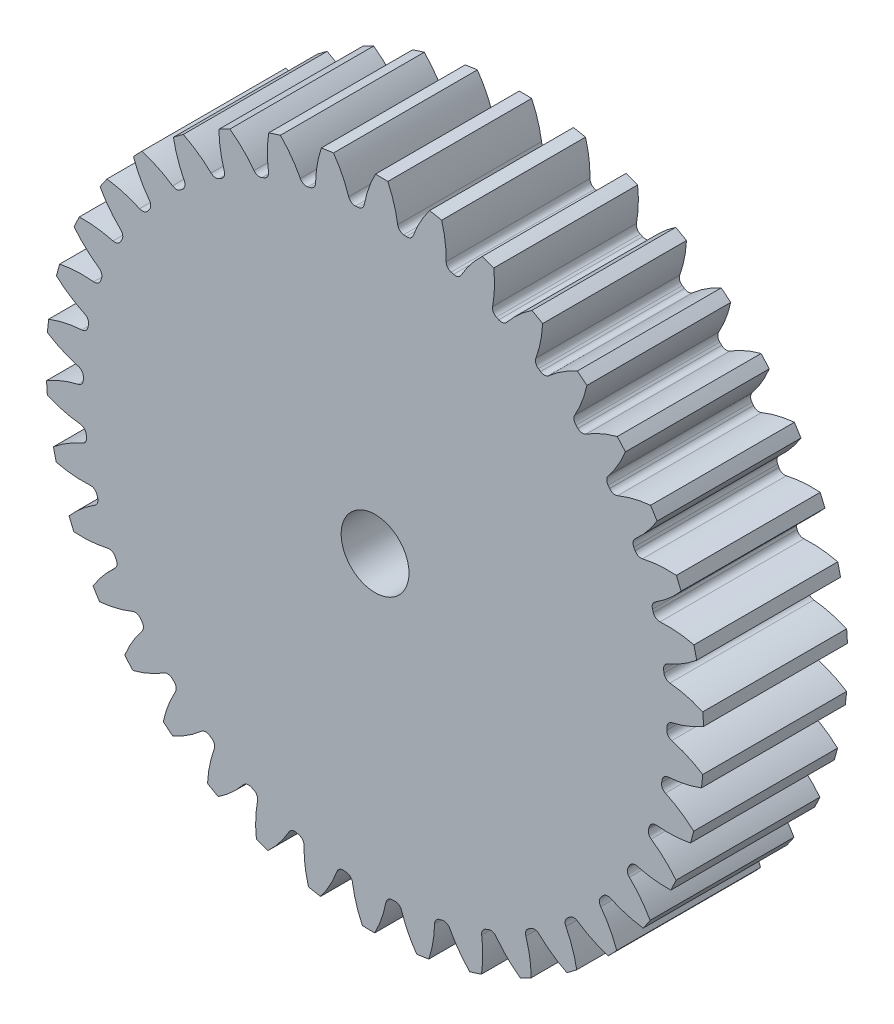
SolidWorks part; units mm, degrees
ref_plane "Front" through (0, 0, 0) normal (0, 0, 1) x (1, 0, 0)
ref_plane "Top" through (0, 0, 0) normal (0, 1, 0) x (1, 0, 0)
ref_plane "Right" through (0, 0, 0) normal (1, 0, 0) x (0, 0, -1)
sketch "Sketch3" plane through (0, 0, 0) normal (0, 0, 1) x (1, 0, 0)
  circle A0 centre (0, 0) radius 203.2
  dimension "od" = 406.4
extrude "gearBody" add sketch "Sketch3" along normal blind 88.9
sketch "Sketch2" plane through (0, 0, 0) normal (0, 0, 1) x (1, 0, 0)
  line L0 (0, 0) -> (167.5901, 69.4181) construction
  line L1 (202.6781, -17.1439) -> (0, 0) construction
  line L2 (0, 0) -> (36.3143, 0) construction
  line L3 (192.9963, 4.1064) -> (192.6798, -11.7873) construction
  line L5 (192.8381, -3.8405) -> (0, 0) construction
  line L7 (0, 0) -> (181.3983, 0) construction
  arc A0 (181.3969, 0.7124) -> (181.2247, -7.9343) centre (0, 0) ccw construction
  arc A1 (203.003, 8.9448) -> (202.4859, -17.0203) centre (0, 0) ccw construction
  arc A2 (192.9963, 4.1064) -> (192.6798, -11.7873) centre (0, 0) ccw construction
  arc A3 (180.2865, -4.3906) -> (180.3184, -2.791) centre (0, 0) ccw
  arc A4 (202.6781, -17.1439) -> (183.3213, -8.4776) centre (164.6934, -76.0357) ccw
  arc A5 (202.6781, -17.1439) -> (203.2, 9.0606) centre (0, 0) ccw
  arc A6 (203.2, 9.0606) -> (183.5134, 1.1719) centre (167.5901, 69.4181) cw
  arc A7 (180.3184, -2.791) -> (183.5134, 1.1719) centre (184.453, -2.855) cw
  arc A8 (183.3213, -8.4776) -> (180.2865, -4.3906) centre (184.4204, -4.4913) cw
  point P6 (203.2, 9.0606)
  point P22 (202.6781, -17.1439)
  dimension "baseDia" = 362.7965
  dimension "od" = 406.4
  dimension "pd" = 386.08
  dimension "rd" = 360.68
  dimension "rFillet" = 4.1351
  dimension "pointX" = 203.2
  dimension "pointY" = 9.0606
  dimension "CTT" = 15.8937
  dimension "flankCenterAngle" = 22.5
extrude "toothCut" cut sketch "Sketch2" along normal through all
pattern_circular "CirPattern1" count 38 over 360 about axis through (0, 0, 0) along (0, 0, 1) of "toothCut"
sketch "hub1Dia" plane through (0, 0, 0) normal (0, 0, -1) x (-1, 0, 0)
  circle A0 centre (0, 0) radius 12.7
  dimension "hub1Dia" = 25.4
sketch "hub2Dia" plane through (0, 0, 88.9) normal (0, 0, 1) x (1, 0, 0)
  circle A0 centre (0, 0) radius 12.7
  dimension "hub2dia" = 25.4
sketch "boreDia" plane through (0, 0, 0) normal (0, 0, 1) x (1, 0, 0)
  circle A0 centre (0, 0) radius 20.955
  dimension "boreDia" = 41.91
extrude "bore" cut sketch "boreDia" against normal mid plane 25400
